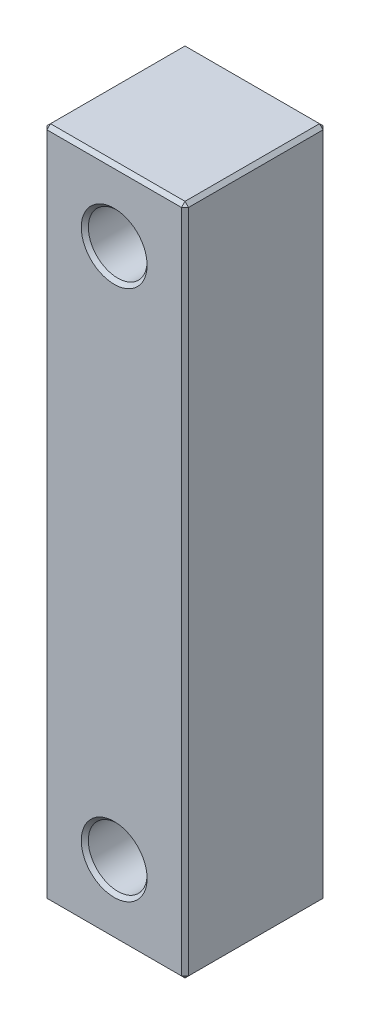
SolidWorks part; units mm, degrees
ref_plane "XY" through (0, 0, 0) normal (0, 0, 1) x (1, 0, 0)
ref_plane "XZ" through (0, 0, 0) normal (0, 1, 0) x (1, 0, 0)
ref_plane "YZ" through (0, 0, 0) normal (1, 0, 0) x (0, 0, -1)
sketch "Esquisse1" plane through (0, 0, 0) normal (0, 0, 1) x (1, 0, 0)
  line L0 (-47.5, 47.5) -> (-27.5, 47.5)
  line L1 (-47.5, 47.5) -> (-47.5, -47.5)
  line L2 (-27.5, -47.5) -> (-47.5, -47.5)
  line L3 (-27.5, -47.5) -> (-27.5, 47.5)
  line L5 (-55.8539, 0) -> (0, 0) construction
  circle A0 centre (-37.5, -37.5) radius 4.15
  circle A1 centre (-37.5, 37.5) radius 4.15
  dimension "D6" = 8.3
  dimension "D1" = 20
  dimension "D2" = 95
  dimension "D3" = 47.5
  dimension "D4" = 47.5
  dimension "D5" = 10
  dimension "D7" = 37.5
extrude "Base-Extrusion" add sketch "Esquisse1" against normal blind 20
chamfer "Chanfrein3" distance 0.5 angle 45
